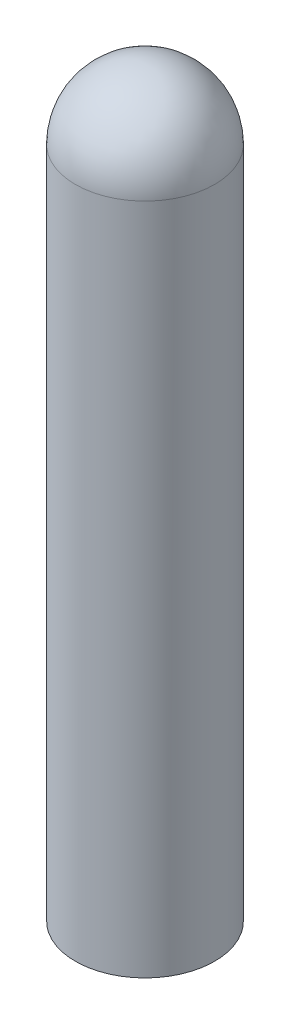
SolidWorks part; units mm, degrees
ref_plane "Face" through (0, 0, 0) normal (0, 0, 1) x (1, 0, 0)
ref_plane "Dessus" through (0, 0, 0) normal (0, 1, 0) x (1, 0, 0)
ref_plane "Droite" through (0, 0, 0) normal (1, 0, 0) x (0, 0, -1)
sketch "Esquisse2" plane through (0, 0, 0) normal (0, 0, 1) x (1, 0, 0)
  line L3 (0, -10) -> (0, 41)
  line L6 (5, -8.6603) -> (5, 39.6603)
  line L7 (0, -10) -> (0, 41) construction
  arc A0 (0, -10) -> (5, -8.6603) centre (0, 0) ccw
  arc A2 (5, 39.6603) -> (0, 41) centre (0, 31) ccw
  dimension "D1" = 20
  dimension "D2" = 10
  dimension "D3" = 31
  dimension "D4" = 5
revolve "Base-Révolution" add sketch "Esquisse2" angle 360 about L7
sketch "Esquisse3" plane through (0, 0, 0) normal (0, 0, 1) x (1, 0, 0)
  line L0 (0, -10) -> (0, 41) construction
  line L2 (0, 34.6603) -> (0, 44.6603)
  line L3 (5, -8.6603) -> (5, 39.6603) construction
  arc A0 (0, 34.6603) -> (0, 44.6603) centre (0, 39.6603) ccw
revolve "Révolution1" add sketch "Esquisse3" angle 360 about axis through (0, -10, 0) along (0, 1, 0)
